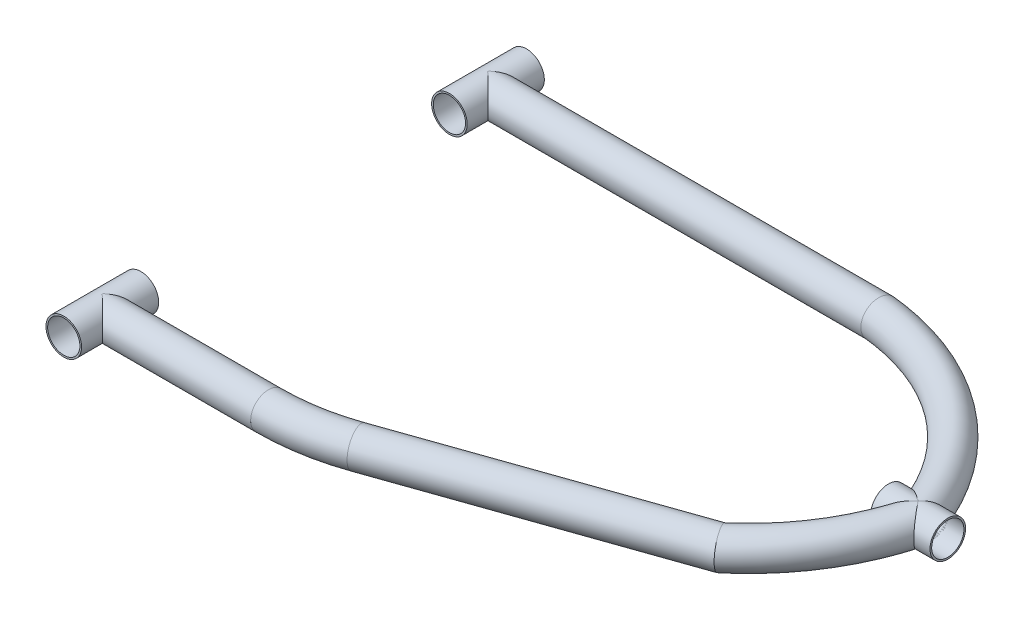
SolidWorks part; units mm, degrees
ref_plane "Front Plane" through (0, 0, 0) normal (0, 0, 1) x (1, 0, 0)
ref_plane "Top Plane" through (0, 0, 0) normal (0, 1, 0) x (1, 0, 0)
ref_plane "Right Plane" through (0, 0, 0) normal (1, 0, 0) x (0, 0, -1)
sketch "Sketch1" plane through (0, 0, 0) normal (0, 1, 0) x (1, 0, 0)
  line L0 (0, 123.825) -> (0, 82.55) construction
  line L1 (0, 123.825) -> (0, 82.55)
  line L2 (0, -123.825) -> (0, -82.55)
  line L3 (0, 123.825) -> (0, 82.55) construction
  line L4 (0, 19.05) -> (330.2, 19.05) construction
  line L5 (330.2, 19.05) -> (298.45, 19.05)
  line L6 (0, 103.1875) -> (209.55, 103.1875)
  line L7 (0, -103.1875) -> (88.9, -103.1875)
  line L8 (129.8422, -96.223) -> (273.6704, -45.8326)
  line L10 (0, -82.55) -> (0, -123.825) construction
  line L14 (0, 76.2) -> (0, -76.2) construction
  line L15 (0, 76.2) -> (0, 19.05) construction
  arc A0 (209.55, 103.1875) -> (314.325, 19.05) centre (196.8123, -19.9806) cw
  arc A1 (314.325, 19.05) -> (273.6704, -45.8326) centre (194.2102, 49.1342) cw
  arc A2 (88.9, -103.1875) -> (129.8422, -96.223) centre (88.9, 20.6375) ccw
  point P19 (109.9634, -103.1875)
  dimension "D7" = 123.825
  dimension "D9" = 123.825
  dimension "D11" = 123.825
  dimension "D2" = 41.275
  dimension "D5" = 330.2
  dimension "D6" = 31.75
  dimension "D8" = 209.55
  dimension "D10" = 88.9
  dimension "D12" = 152.4
other "Structural Member1"
ref_plane "Plane1" through (0, 0, -123.825) normal (0, 0, 1) x (1, 0, 0)
sketch "Sketch11" plane through (0, 0, -123.825) normal (0, 0, 1) x (1, 0, 0)
  circle A0 centre (0, 0) radius 8.636
  circle A1 centre (0, 0) radius 9.525
  point P5 (0, 0)
  dimension "Out_dia" = 19.05
  dimension "D1" = 0.889
other "Structural Member2"
ref_plane "Plane2" through (330.2, 0, -19.05) normal (-1, 0, 0) x (0, 0, 1)
sketch "Sketch12" plane through (330.2, 0, -19.05) normal (-1, 0, 0) x (0, 0, 1)
  circle A0 centre (0, 0) radius 8.636
  circle A1 centre (0, 0) radius 9.525
  point P5 (0, 0)
  dimension "Out_dia" = 19.05
  dimension "D1" = 0.889
other "Structural Member3"
ref_plane "Plane3" through (0, 0, -103.1875) normal (1, 0, 0) x (0, 0, -1)
sketch "Sketch13" plane through (0, 0, -103.1875) normal (1, 0, 0) x (0, 0, -1)
  circle A0 centre (0, 0) radius 8.636
  circle A1 centre (0, 0) radius 9.525
  point P5 (0, 0)
  dimension "Out_dia" = 19.05
  dimension "D1" = 0.889
sketch "Sketch14" plane through (330.2, 0, 0) normal (1, 0, 0) x (0, 0, -1)
  circle A0 centre (19.05, 0) radius 8.636 construction
  circle A1 centre (19.05, 0) radius 8.636
extrude "Cut-Extrude1" cut sketch "Sketch14" against normal blind 76.2
other "Structural Member4"
ref_plane "Plane4" through (0, 0, 103.1875) normal (1, 0, 0) x (0, 0, -1)
sketch "Sketch15" plane through (0, 0, 103.1875) normal (1, 0, 0) x (0, 0, -1)
  circle A0 centre (0, 0) radius 8.636
  circle A1 centre (0, 0) radius 9.525
  point P5 (0, 0)
  dimension "Out_dia" = 19.05
  dimension "D1" = 0.889
sketch "Sketch16" plane through (330.2, 0, 0) normal (1, 0, 0) x (0, 0, -1)
  circle A0 centre (19.05, 0) radius 8.636 construction
  circle A1 centre (19.05, 0) radius 8.636
extrude "Cut-Extrude2" cut sketch "Sketch16" against normal blind 76.2
sketch "Sketch17" plane through (0, 0, 123.825) normal (0, 0, 1) x (1, 0, 0)
  circle A0 centre (0, 0) radius 8.636 construction
  circle A1 centre (0, 0) radius 8.636
extrude "Cut-Extrude3" cut sketch "Sketch17" against normal through all
ref_point "Point1"
sketch3d "3DSketch1"
  line L0 (330.2, 0, -19.05) -> (355.7168, 0, -19.05)
